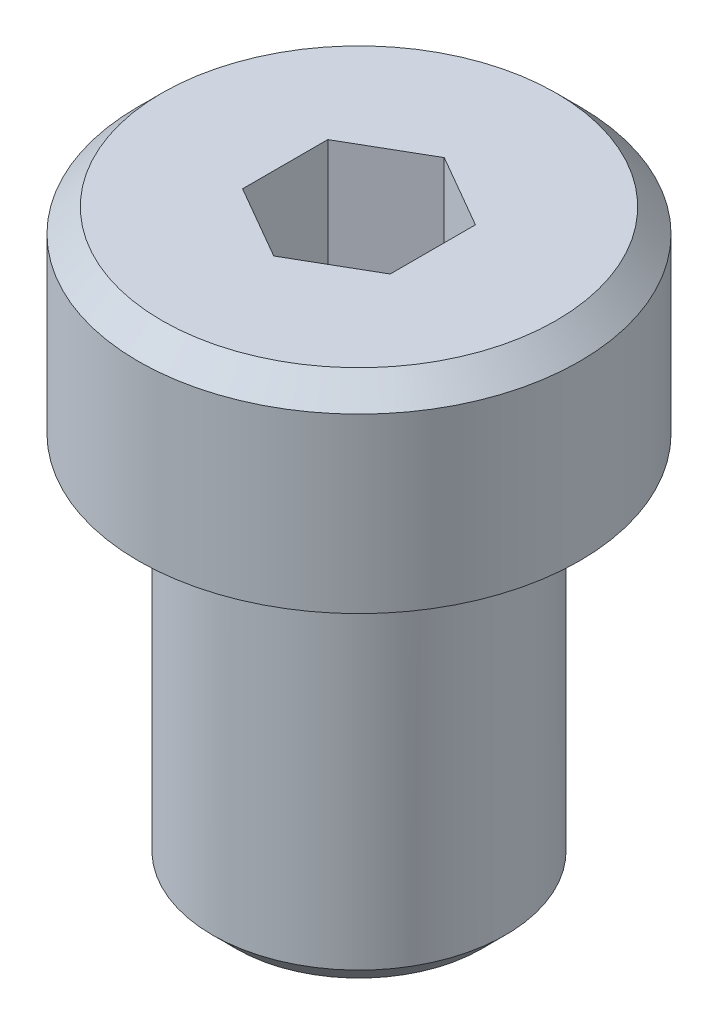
SolidWorks part; units mm, degrees
ref_plane "Plane1" through (0, 0, 0) normal (0, 0, 1) x (1, 0, 0)
ref_plane "Plane2" through (0, 0, 0) normal (0, 1, 0) x (1, 0, 0)
ref_plane "Plane3" through (0, 0, 0) normal (1, 0, 0) x (0, 0, -1)
sketch "Sketch2" plane through (0, 0, 0) normal (0, 0, 1) x (1, 0, 0)
  line L0 (0, 0) -> (7.1374, 0)
  line L1 (7.1374, 0) -> (7.1374, 5.588)
  line L2 (7.1374, 5.588) -> (6.3754, 6.35)
  line L3 (6.3754, 6.35) -> (0, 6.35)
  line L4 (0, 6.35) -> (0, 0)
  line L5 (0, 0) -> (0, 98.4216) construction
  dimension "D1" = 14.2748
  dimension "D2" = 6.35
  dimension "D3" = 45
  dimension "D4" = 0.762
revolve "Base-Revolve" add sketch "Sketch2" angle 360 about L5
sketch "Sketch3" plane through (0, 0, 0) normal (0, 0, 1) x (1, 0, 0)
  line L0 (0, 0) -> (0, 7.8563) construction
  line L1 (0, -12.446) -> (4.7371, -12.446)
  line L6 (4.7371, -12.446) -> (4.7371, 0)
  line L9 (4.7371, 0) -> (0, 0)
  line L10 (0, 0) -> (0, -12.446)
  line L11 (-7.1374, 0) -> (7.1374, 0) construction
  dimension "D1" = 12.446
  dimension "D4" = 9.4742
revolve "Boss-Revolve1" add sketch "Sketch3" angle 360 about L0
ref_plane "Plane4" through (0, 6.35, 0) normal (0, 1, 0) x (-1, 0, 0)
sketch "Sketch4" plane through (0, 6.35, 0) normal (0, 1, 0) x (-1, 0, 0)
  line L0 (2.3876, 1.3785) -> (0, 2.757)
  line L1 (0, 2.757) -> (-2.3876, 1.3785)
  line L2 (-2.3876, 1.3785) -> (-2.3876, -1.3785)
  line L3 (-2.3876, -1.3785) -> (0, -2.757)
  line L4 (0, -2.757) -> (2.3876, -1.3785)
  line L5 (2.3876, -1.3785) -> (2.3876, 1.3785)
extrude "Cut-Extrude1" cut sketch "Sketch4" against normal blind 3.5814
chamfer "Chamfer1" distance 0.762 angle 45 1 edges at (0, -12.446, -4.7371)
